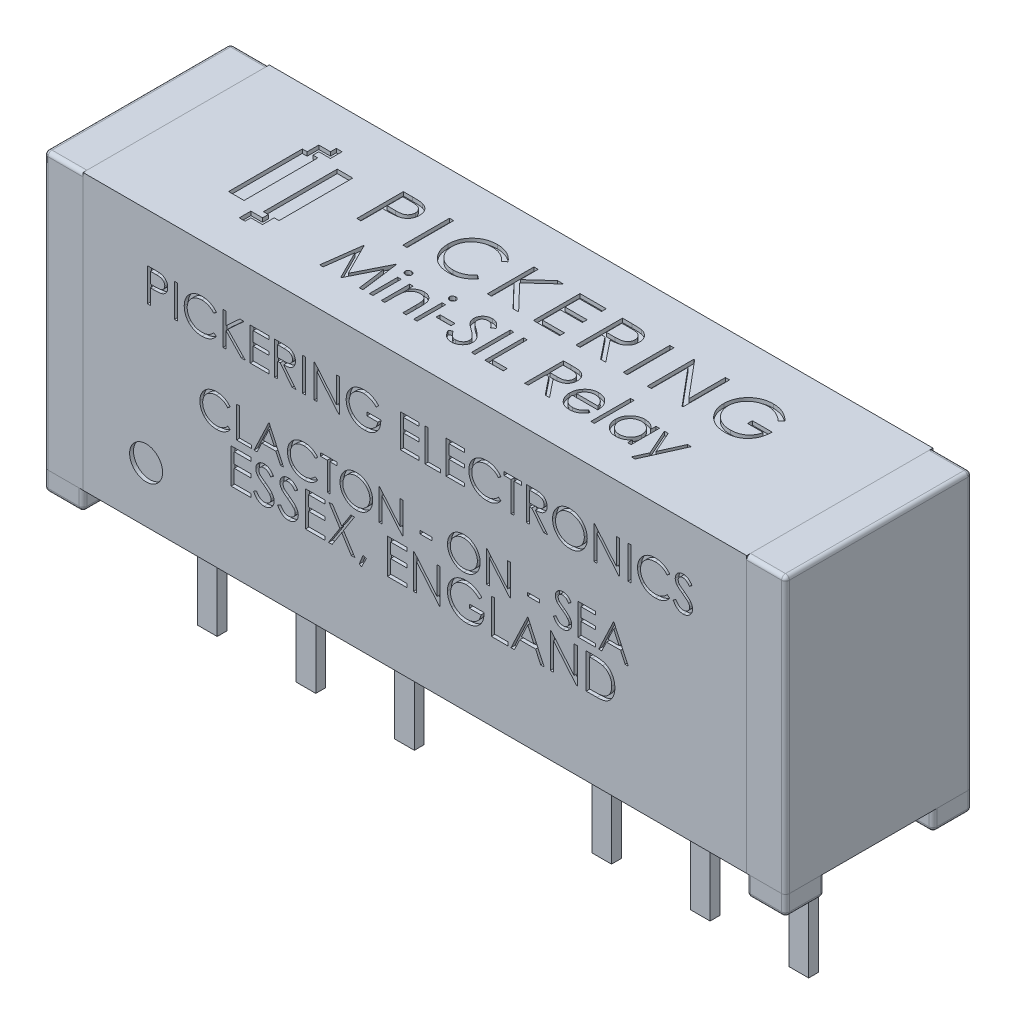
SolidWorks part; units mm, degrees
ref_plane "Front Plane" through (0, 0, 0) normal (0, 0, 1) x (1, 0, 0)
ref_plane "Top Plane" through (0, 0, 0) normal (0, 1, 0) x (1, 0, 0)
ref_plane "Right Plane" through (0, 0, 0) normal (1, 0, 0) x (0, 0, -1)
sketch "Sketch1" plane through (0, 0, 0) normal (0, 1, 0) x (1, 0, 0)
  line L1 (8.55, -2.4) -> (-8.55, -2.4)
  line L2 (8.55, -2.4) -> (8.55, 2.4)
  line L3 (8.55, 2.4) -> (-8.55, 2.4)
  line L4 (-8.55, -2.4) -> (-8.55, 2.4)
  line L5 (8.55, -2.4) -> (-8.55, 2.4) construction
  line L6 (8.55, 2.4) -> (-8.55, -2.4) construction
  point P0 (0, 0)
  dimension "D1" = 4.8
  dimension "D2" = 17.1
extrude "Main Body" add sketch "Sketch1" along normal blind 7.092
sketch "Sketch2" plane through (8.55, 0, 0) normal (1, 0, 0) x (0, 0, -1)
  line L1 (-2.4, 7.092) -> (2.4, 7.092)
  line L2 (-2.4, 7.092) -> (-2.4, 0)
  line L3 (-2.4, 0) -> (2.4, 0)
  line L4 (2.4, 7.092) -> (2.4, 0)
extrude "Side Right" add sketch "Sketch2" along normal blind 1 separate body
sketch "Sketch3" plane through (-8.55, 0, 0) normal (-1, 0, 0) x (0, 0, 1)
  line L1 (-2.4, 7.092) -> (2.4, 7.092)
  line L2 (-2.4, 7.092) -> (-2.4, 0)
  line L3 (-2.4, 0) -> (2.4, 0)
  line L4 (2.4, 7.092) -> (2.4, 0)
extrude "Side Left" add sketch "Sketch3" along normal blind 1 separate body
sketch "Sketch4" plane through (0, 0, 0) normal (0, -1, 0) x (1, 0, 0)
  line L0 (-8.55, -2.4) -> (-8.55, 2.4) construction
  line L1 (-9.55, 2.4) -> (-8.55, 2.4)
  line L2 (-9.55, 2.4) -> (-9.55, 1.4)
  line L3 (-9.55, 1.4) -> (-8.55, 1.4)
  line L4 (-8.55, 2.4) -> (-8.55, 1.4)
  line L5 (8.55, 2.4) -> (8.55, -2.4) construction
  line L6 (-9.55, -2.4) -> (-8.55, -2.4)
  line L7 (-9.55, -2.4) -> (-9.55, -1.4)
  line L8 (-9.55, -1.4) -> (-8.55, -1.4)
  line L9 (-8.55, -2.4) -> (-8.55, -1.4)
  line L10 (9.55, 2.4) -> (8.55, 2.4)
  line L11 (9.55, 2.4) -> (9.55, 1.4)
  line L12 (9.55, 1.4) -> (8.55, 1.4)
  line L13 (8.55, 2.4) -> (8.55, 1.4)
  line L14 (8.55, 2.4) -> (8.55, -2.4) construction
  line L15 (9.55, -2.4) -> (8.55, -2.4)
  line L16 (9.55, -2.4) -> (9.55, -1.4)
  line L17 (9.55, -1.4) -> (8.55, -1.4)
  line L18 (8.55, -2.4) -> (8.55, -1.4)
  dimension "D1" = 1
  dimension "D2" = 1
extrude "Feet" add sketch "Sketch4" along normal blind 0.508 separate body
sketch "Sketch5" plane through (0, 0, 0) normal (0, -1, 0) x (1, 0, 0)
  line L1 (-7.366, -0.127) -> (-7.874, -0.127)
  line L2 (-7.366, -0.127) -> (-7.366, 0.127)
  line L3 (-7.366, 0.127) -> (-7.874, 0.127)
  line L4 (-7.874, -0.127) -> (-7.874, 0.127)
  line L5 (-7.366, -0.127) -> (-7.874, 0.127) construction
  line L6 (-7.366, 0.127) -> (-7.874, -0.127) construction
  line L7 (-2.286, -0.127) -> (-2.794, -0.127)
  line L8 (-2.286, -0.127) -> (-2.286, 0.127)
  line L9 (-2.286, 0.127) -> (-2.794, 0.127)
  line L10 (-2.794, -0.127) -> (-2.794, 0.127)
  line L11 (-2.286, -0.127) -> (-2.794, 0.127) construction
  line L12 (-2.286, 0.127) -> (-2.794, -0.127) construction
  line L13 (-5.334, -0.127) -> (-4.826, -0.127)
  line L14 (-5.334, -0.127) -> (-5.334, 0.127)
  line L15 (-5.334, 0.127) -> (-4.826, 0.127)
  line L16 (-4.826, -0.127) -> (-4.826, 0.127)
  line L17 (-5.334, -0.127) -> (-4.826, 0.127) construction
  line L18 (-5.334, 0.127) -> (-4.826, -0.127) construction
  line L19 (2.286, -0.127) -> (2.794, -0.127)
  line L20 (2.286, -0.127) -> (2.286, 0.127)
  line L21 (2.286, 0.127) -> (2.794, 0.127)
  line L22 (2.794, -0.127) -> (2.794, 0.127)
  line L23 (2.286, -0.127) -> (2.794, 0.127) construction
  line L24 (2.286, 0.127) -> (2.794, -0.127) construction
  line L25 (4.826, -0.127) -> (5.334, -0.127)
  line L26 (4.826, -0.127) -> (4.826, 0.127)
  line L27 (4.826, 0.127) -> (5.334, 0.127)
  line L28 (5.334, -0.127) -> (5.334, 0.127)
  line L29 (4.826, -0.127) -> (5.334, 0.127) construction
  line L30 (4.826, 0.127) -> (5.334, -0.127) construction
  line L31 (7.366, -0.127) -> (7.874, -0.127)
  line L32 (7.366, -0.127) -> (7.366, 0.127)
  line L33 (7.366, 0.127) -> (7.874, 0.127)
  line L34 (7.874, -0.127) -> (7.874, 0.127)
  line L35 (7.366, -0.127) -> (7.874, 0.127) construction
  line L36 (7.366, 0.127) -> (7.874, -0.127) construction
  line L37 (9.55, 2.4) -> (9.55, -2.4) construction
  point P0 (-7.62, 0)
  point P5 (-2.54, 0)
  point P10 (-5.08, 0)
  point P15 (2.54, 0)
  point P20 (5.08, 0)
  point P25 (7.62, 0)
  point P33 (1.2204, 3.3065)
  dimension "D1" = 0.254
  dimension "D2" = 0.508
  dimension "D3" = 0.508
  dimension "D4" = 0.254
  dimension "D5" = 0.508
  dimension "D6" = 0.254
  dimension "D7" = 0.508
  dimension "D8" = 0.254
  dimension "D9" = 0.254
  dimension "D10" = 0.508
  dimension "D11" = 0.254
  dimension "D12" = 0.508
  dimension "D13" = 2.54
  dimension "D14" = 2.54
  dimension "D15" = 2.54
  dimension "D16" = 5.08
  dimension "D17" = 2.54
  dimension "D18" = 1.93
extrude "Pins" add sketch "Sketch5" along normal blind 3.808
sketch "Sketch6"
  dimension "D1" = 10.4
  dimension "D2" = 2.3
  dimension "D3" = 0.4
  dimension "D4" = 0.4
  dimension "D5" = 1.9
  dimension "D6" = 1.9
  dimension "D7" = 1.45
  dimension "D8" = 1.45
  dimension "D9" = 1.3
  dimension "D10" = 3.3
  dimension "D11" = 3.3
  dimension "D12" = 3.7
  dimension "D13" = 0.3
  dimension "D14" = 0.15
  dimension "D15" = 0.15
  dimension "D16" = 0.15
  dimension "D17" = 0.15
  dimension "D18" = 0.3
  dimension "D19" = 0.125
  dimension "D20" = 0.15
  dimension "D21" = 0.125
  dimension "D22" = 0.3
  dimension "D23" = 0.15
  dimension "D24" = 0.3
  dimension "D25" = 0.15
  dimension "D26" = 0.15
extrude "Lettering top" cut sketch "Sketch6" against normal blind 0.1
sketch "Sketch7"
  dimension "D10" = 0.85
  dimension "D11" = 1.425
  dimension "D1" = 14
  dimension "D2" = 2.1
  dimension "D3" = 2.55
  dimension "D4" = 11.2
  dimension "D5" = 3.95
  dimension "D6" = 9.7
  dimension "D7" = 4.7
  dimension "D8" = 1.1
  dimension "D9" = 2
  dimension "D12" = 2.625
extrude "Lettering front" cut sketch "Sketch7" against normal blind 0.1
sketch "Sketch8"
  dimension "D1" = 13.5
  dimension "D2" = 2.8
extrude "Part number" add sketch "Sketch8" along normal blind 0.0001
fillet "Fillet1" radius 0.1 5 edges at (-9.05, 7.092, 2.4) (-9.05, 7.092, -2.4) (-9.55, 3.546, -2.4) (-9.55, 7.092, 0) (-9.55, 3.546, 2.4)
fillet "Fillet2" radius 0.1 5 edges at (9.05, 7.092, -2.4) (9.05, 7.092, 2.4) (9.55, 3.546, -2.4) (9.55, 3.546, 2.4) (9.55, 7.092, 0)
fillet "Fillet3" radius 0.1 8 edges at (-9.05, -0.508, -1.4) (-8.55, -0.508, -1.9) (-9.05, -0.508, -2.4) (-9.55, -0.508, -1.9) (-8.55, -0.254, -1.4) (-8.55, -0.254, -2.4) (-9.55, -0.254, -1.4) (-9.55, -0.254, -2.4)
fillet "Fillet4" radius 0.1 8 edges at (-9.05, -0.508, 2.4) (-8.55, -0.508, 1.9) (-9.05, -0.508, 1.4) (-9.55, -0.508, 1.9) (-8.55, -0.254, 1.4) (-8.55, -0.254, 2.4) (-9.55, -0.254, 1.4) (-9.55, -0.254, 2.4)
fillet "Fillet5" radius 0.1 8 edges at (9.05, -0.508, 1.4) (8.55, -0.508, 1.9) (9.05, -0.508, 2.4) (9.55, -0.508, 1.9) (9.55, -0.254, 1.4) (8.55, -0.254, 1.4) (8.55, -0.254, 2.4) (9.55, -0.254, 2.4)
fillet "Fillet6" radius 0.1 8 edges at (9.05, -0.508, -2.4) (8.55, -0.508, -1.9) (9.05, -0.508, -1.4) (9.55, -0.508, -1.9) (9.55, -0.254, -1.4) (8.55, -0.254, -1.4) (8.55, -0.254, -2.4) (9.55, -0.254, -2.4)
